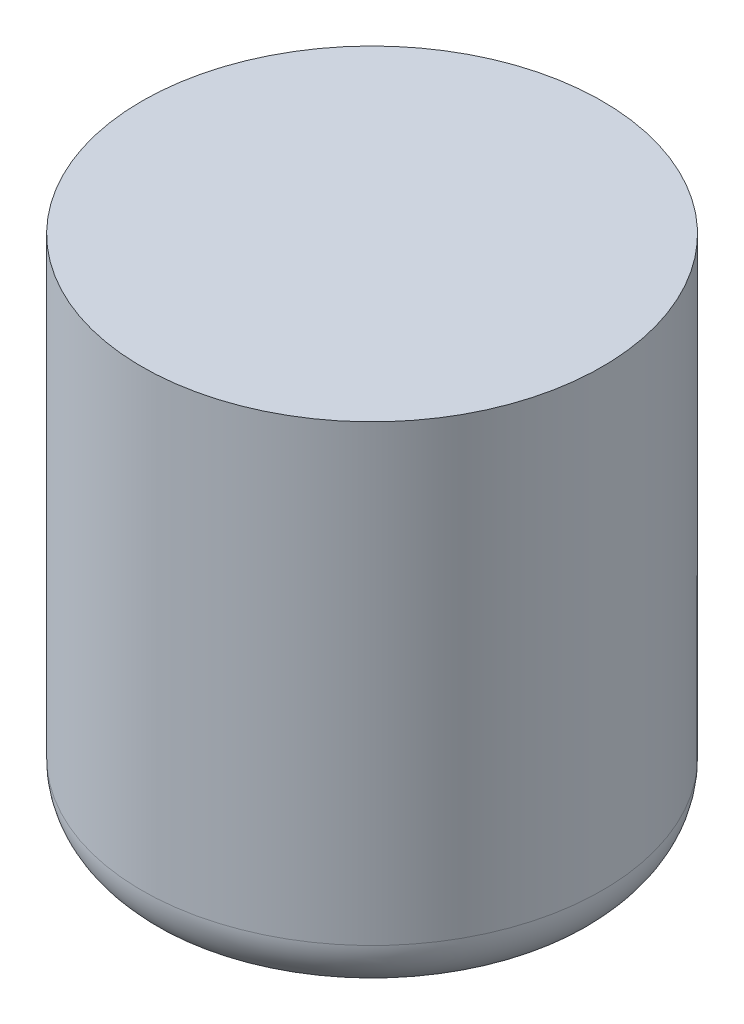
SolidWorks part; units mm, degrees
ref_plane "Plan de face" through (0, 0, 0) normal (0, 0, 1) x (1, 0, 0)
ref_plane "Plan de dessus" through (0, 0, 0) normal (0, 1, 0) x (1, 0, 0)
ref_plane "Plan de droite" through (0, 0, 0) normal (1, 0, 0) x (0, 0, -1)
sketch "Esquisse1" plane through (0, 0, 0) normal (0, 0, 1) x (1, 0, 0)
  line L0 (-120.0087, 54.6389) -> (-120.0087, 151.3789)
  line L1 (-70.9187, 164.8994) -> (-70.9187, 30.1746) construction
  line L2 (-120.0087, 151.3789) -> (-70.9187, 151.3789)
  line L3 (-116.4892, 46.1489) -> (-70.9187, 46.1489)
  line L4 (-70.9187, 46.1489) -> (-70.9187, 151.3789)
  arc A0 (-120.0087, 54.6389) -> (-116.4892, 46.1489) centre (-108.0087, 54.6389) ccw
  dimension "D1" = 49.09
  dimension "D2" = 12
  dimension "D3" = 8.49
  dimension "D5" = 96.74
revolve "Révolution1" add sketch "Esquisse1" angle 360 about L1
